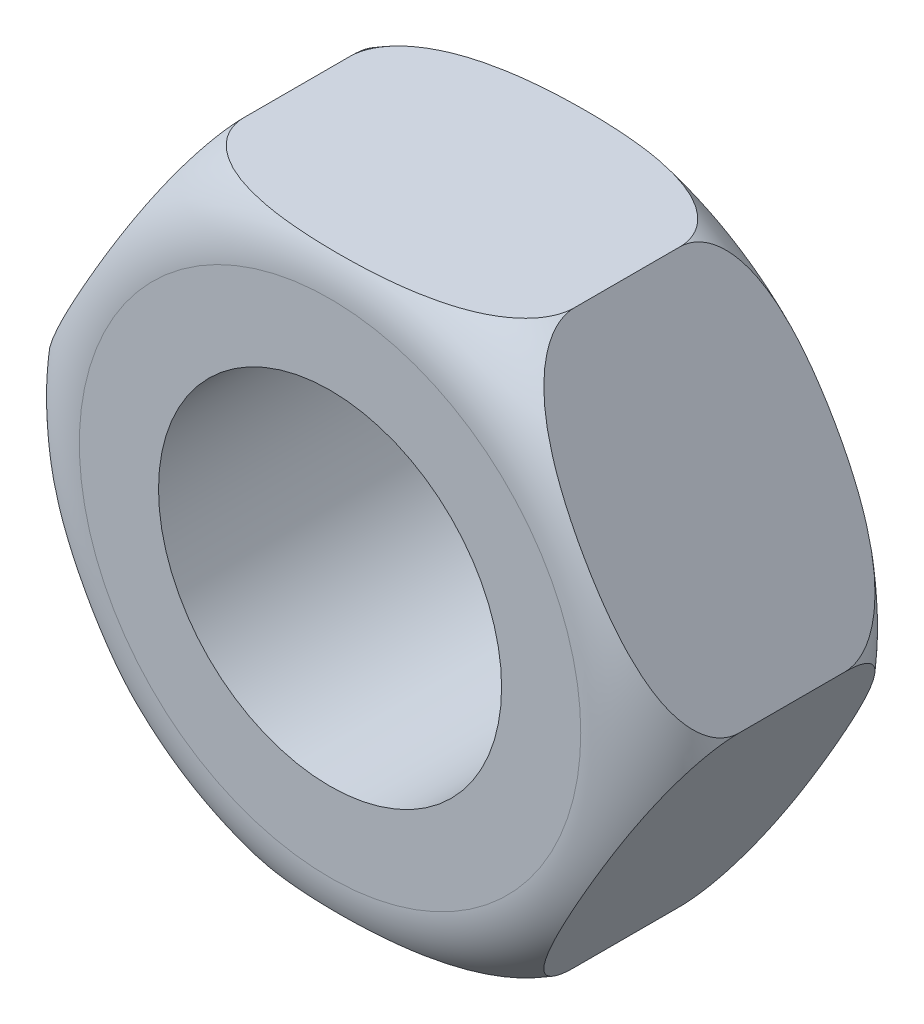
SolidWorks part; units mm, degrees
ref_plane "Front Plane" through (0, 0, 0) normal (0, 0, 1) x (1, 0, 0)
ref_plane "Top Plane" through (0, 0, 0) normal (0, 1, 0) x (1, 0, 0)
ref_plane "Right Plane" through (0, 0, 0) normal (1, 0, 0) x (0, 0, -1)
imported_body "Imported3"
hole_wizard "Ø13.0 (13) Diameter Hole1" positions "Sketch2" profile "Sketch1" hole size "Ø13.0" standard "ANSI Metric"
sketch "Sketch2" plane through (0, 0, 10) normal (0, 0, 1) x (1, 0, 0)
  point P0 (0, 0)
sketch "Sketch1" plane through (0, 0, 10) normal (1, 0, 0) x (0, -1, 0)
  line L0 (0, 0) -> (0, 10.3682)
  line L1 (0, 10.3682) -> (6.5, 10.3682)
  line L2 (6.5, 10.3682) -> (6.5, 0)
  line L5 (6.5, 0) -> (0, 0)
  line L11 (0, -6.35) -> (0, 107.95) construction
  dimension "Thru Hole Dia." = 13
  dimension "Thru Hole Depth" = 10.3682
